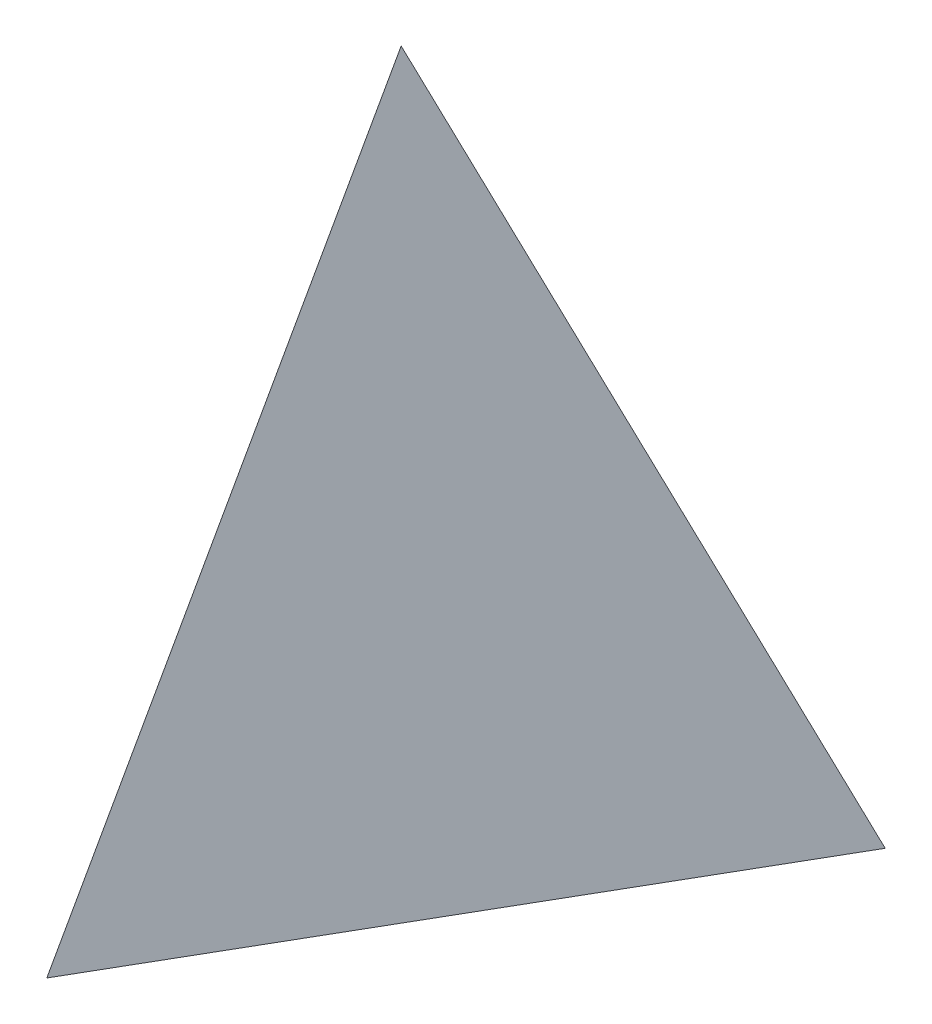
SolidWorks part; units mm, degrees
ref_plane "前视基准面" through (0, 0, 0) normal (0, 0, 1) x (1, 0, 0)
ref_plane "上视基准面" through (0, 0, 0) normal (0, 1, 0) x (1, 0, 0)
ref_plane "右视基准面" through (0, 0, 0) normal (1, 0, 0) x (0, 0, -1)
sketch "草图1" plane through (0, 0, 0) normal (0, 1, 0) x (1, 0, 0)
  line L1 (0, -45) -> (38.9711, 22.5)
  line L2 (38.9711, 22.5) -> (-38.9711, 22.5)
  line L3 (-38.9711, 22.5) -> (0, -45)
  circle A0 centre (0, 0) radius 22.5 construction
  dimension "D1" = 45
ref_plane "基准面1" through (0, 80, 0) normal (0, 1, 0) x (-1, 0, 0)
sketch "草图2" plane through (0, 80, 0) normal (0, 1, 0) x (-1, 0, 0)
  point P0 (0, 0)
loft "放样1" add profiles "草图2", "草图1"
